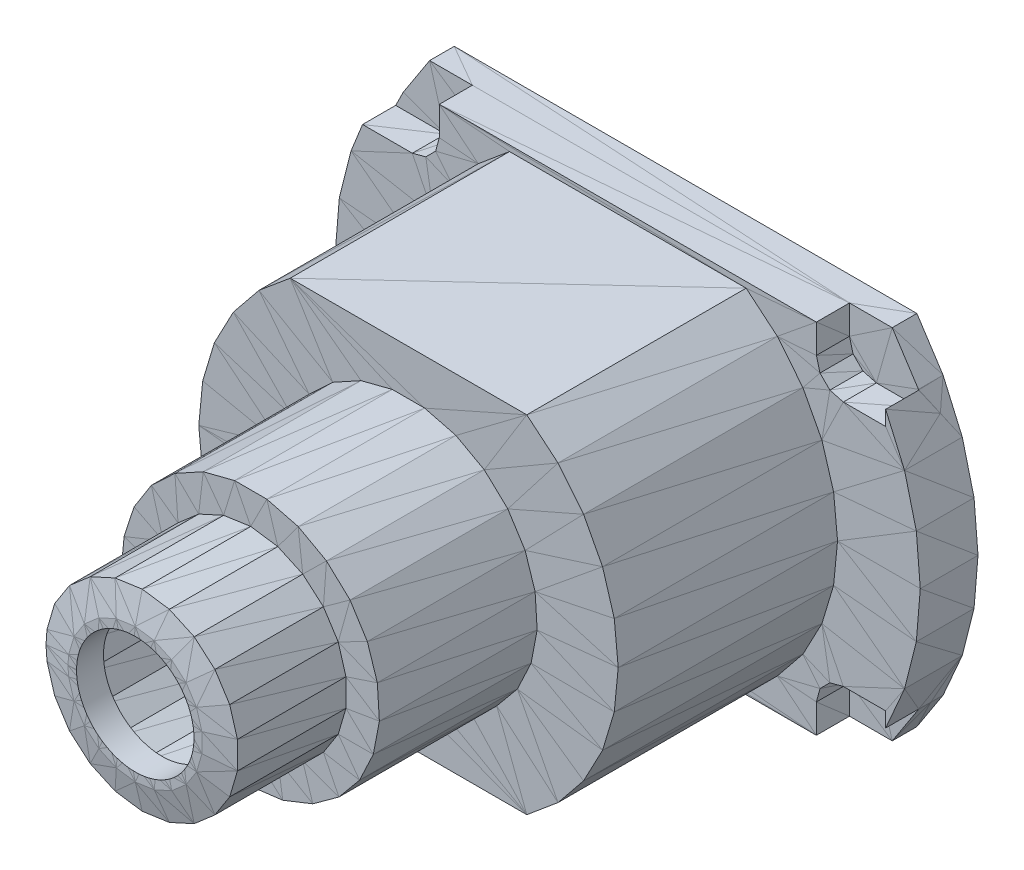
SolidWorks part; units mm, degrees
ref_plane "Front Plane" through (0, 0, 0) normal (0, 0, 1) x (1, 0, 0)
ref_plane "Top Plane" through (0, 0, 0) normal (0, 1, 0) x (1, 0, 0)
ref_plane "Right Plane" through (0, 0, 0) normal (1, 0, 0) x (0, 0, -1)
imported_body "Imported1"
sketch "Sketch2" plane through (0, 0, 0) normal (0, 0, 1) x (1, 0, 0)
  circle A0 centre (0, 0) radius 15.25
extrude "Cut-Extrude2" cut sketch "Sketch2" against normal blind 140
sketch "Sketch1" plane through (0, 0, -128) normal (0, 0, 1) x (1, 0, 0)
  line L1 (-58.0573, 51.5302) -> (-47.0174, 51.5302)
  line L2 (-58.0573, 51.5302) -> (-58.0573, -56.7777)
  line L3 (-58.0573, -56.7777) -> (-47.0174, -56.7777)
  line L4 (-47.0174, 51.5302) -> (-47.0174, -56.7777)
extrude "Cut-Extrude1" cut sketch "Sketch1" along normal blind 70
